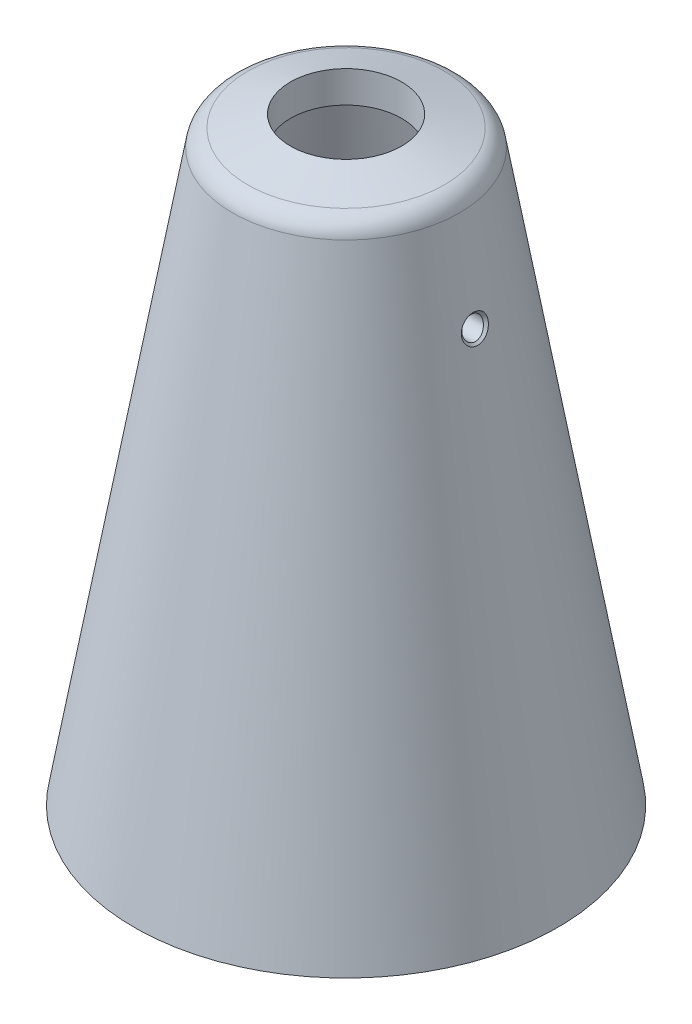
SolidWorks part; units mm, degrees
ref_plane "Front Plane" through (0, 0, 0) normal (0, 0, 1) x (1, 0, 0)
ref_plane "Top Plane" through (0, 0, 0) normal (0, 1, 0) x (1, 0, 0)
ref_plane "Right Plane" through (0, 0, 0) normal (1, 0, 0) x (0, 0, -1)
sketch "Sketch1" plane through (0, 0, 0) normal (0, 0, 1) x (1, 0, 0)
  line L0 (0, 0) -> (0, -25.4) construction
  line L1 (0, -12.7) -> (0, -82.55) construction
  line L2 (0, -82.55) -> (25.4, -82.55) construction
  line L3 (0, -12.7) -> (13.335, -12.7) construction
  line L4 (25.4, -82.55) -> (13.335, -12.7) construction
  line L5 (-3.81, -95.1738) -> (3.81, -95.1738) construction
  line L6 (11.7891, -94.5176) -> (0, 95.25) construction
  line L7 (0, 0) -> (11.7891, -94.5176) construction
  line L8 (6.6675, -12.7) -> (6.6675, -10.809) construction
  line L9 (0, -25.4) -> (15.5286, -25.4) construction
  line L10 (10.113, -12.7) -> (22.178, -82.55) construction
  line L11 (13.335, -12.7) -> (6.6675, -10.809) construction
  line L12 (0, -12.7) -> (10.6339, -15.7159) construction
  line L13 (6.6675, -10.809) -> (6.6675, -14.591) construction
  line L14 (6.6675, -14.591) -> (0, -14.591) construction
  line L15 (3.81, -95.1738) -> (3.81, -88.1137) construction
  line L16 (3.81, -88.1137) -> (19.685, -88.1137) construction
  line L17 (19.685, -88.1137) -> (19.685, -93.1937) construction
  line L18 (15.2087, -88.1137) -> (11.3126, -25.4) construction
  line L19 (12.0873, -24.13) -> (0, -24.13) construction
  circle A0 centre (0, 0) radius 95.25 construction
  circle A1 centre (0, 0) radius 12.7 construction
  circle A2 centre (0, -25.4) radius 69.85 construction
  arc A3 (3.81, -95.1738) -> (19.685, -93.1937) centre (0, 0) ccw construction
  circle A4 centre (7.4953, -25.4) radius 4.7411 construction
  point P29 (12.2364, -25.4)
  dimension "D1" = 190.5
  dimension "D3" = 25.4
  dimension "D8" = 15.875
  dimension "D2" = 25.4
  dimension "D4" = 69.85
  dimension "D5" = 50.8
  dimension "D6" = 26.67
  dimension "D7" = 7.62
  dimension "D9" = 7.11
  dimension "D10" = 3.175
  dimension "D11" = 5.08
  dimension "D12" = 2.54
  dimension "D13" = 7.62
sketch "Sketch2" plane through (0, 0, 0) normal (0, 0, 1) x (1, 0, 0)
  line L0 (0, 0) -> (0, -25.4) construction
  line L1 (0, -12.7) -> (0, -82.55) construction
  line L2 (0, -82.55) -> (25.4, -82.55) construction
  line L3 (0, -12.7) -> (13.335, -12.7) construction
  line L4 (25.4, -82.55) -> (13.335, -12.7) construction
  line L5 (-3.81, -95.1738) -> (3.81, -95.1738) construction
  line L6 (11.7891, -94.5176) -> (0, 95.25) construction
  line L7 (0, 0) -> (11.7891, -94.5176) construction
  line L8 (6.6675, -12.7) -> (6.6675, -10.809) construction
  line L9 (0, -25.4) -> (15.5286, -25.4) construction
  line L10 (10.113, -12.7) -> (22.178, -82.55) construction
  line L11 (13.335, -12.7) -> (6.6675, -10.809) construction
  line L12 (0, -12.7) -> (10.6339, -15.7159) construction
  line L13 (6.6675, -10.809) -> (6.6675, -14.591) construction
  line L14 (6.6675, -14.591) -> (0, -14.591) construction
  line L15 (3.81, -95.1738) -> (3.81, -88.1137) construction
  line L16 (3.81, -88.1137) -> (19.685, -88.1137) construction
  line L17 (19.685, -88.1137) -> (19.685, -93.1937) construction
  line L18 (15.2087, -88.1137) -> (11.3126, -25.4) construction
  line L19 (12.0873, -24.13) -> (0, -24.13) construction
  line L20 (6.6675, -10.809) -> (13.335, -12.7)
  line L21 (13.335, -12.7) -> (25.4, -82.55)
  line L22 (25.4, -82.55) -> (22.178, -82.55)
  line L23 (22.178, -82.55) -> (10.6339, -15.7159)
  line L24 (10.6339, -15.7159) -> (6.6675, -14.591)
  line L25 (6.6675, -14.591) -> (6.6675, -10.809)
  circle A0 centre (0, 0) radius 95.25 construction
  circle A1 centre (0, 0) radius 12.7 construction
  circle A2 centre (0, -25.4) radius 69.85 construction
  arc A3 (3.81, -95.1738) -> (19.685, -93.1937) centre (0, 0) ccw construction
  circle A4 centre (7.4953, -25.4) radius 4.7411 construction
  point P29 (12.2364, -25.4)
  dimension "D1" = 190.5
  dimension "D3" = 25.4
  dimension "D8" = 15.875
  dimension "D2" = 25.4
  dimension "D4" = 69.85
  dimension "D5" = 50.8
  dimension "D6" = 26.67
  dimension "D7" = 7.62
  dimension "D9" = 7.11
  dimension "D10" = 3.175
  dimension "D11" = 5.08
  dimension "D12" = 2.54
  dimension "D13" = 7.62
revolve "Revolve1" add sketch "Sketch2" angle 360 about L1
fillet "Fillet1" radius 2.54 1 edges at (-13.335, -12.7, 0)
sketch "Sketch3" plane through (0, 0, 0) normal (0, 0, 1) x (1, 0, 0)
  line L0 (0, 0) -> (0, -25.4) construction
  line L1 (0, -12.7) -> (0, -82.55) construction
  line L2 (0, -82.55) -> (25.4, -82.55) construction
  line L3 (0, -12.7) -> (13.335, -12.7) construction
  line L4 (25.4, -82.55) -> (13.335, -12.7) construction
  line L5 (-3.81, -95.1738) -> (3.81, -95.1738) construction
  line L6 (11.7891, -94.5176) -> (0, 95.25) construction
  line L7 (0, 0) -> (11.7891, -94.5176) construction
  line L8 (6.6675, -12.7) -> (6.6675, -10.809) construction
  line L9 (0, -25.4) -> (15.5286, -25.4) construction
  line L10 (10.113, -12.7) -> (22.178, -82.55) construction
  line L11 (13.335, -12.7) -> (6.6675, -10.809) construction
  line L12 (0, -12.7) -> (10.6339, -15.7159) construction
  line L13 (6.6675, -10.809) -> (6.6675, -14.591) construction
  line L14 (6.6675, -14.591) -> (0, -14.591) construction
  line L15 (3.81, -95.1738) -> (3.81, -88.1137) construction
  line L16 (3.81, -88.1137) -> (19.685, -88.1137) construction
  line L17 (19.685, -88.1137) -> (19.685, -93.1937) construction
  line L18 (15.2087, -88.1137) -> (11.3126, -25.4) construction
  line L19 (12.0873, -24.13) -> (0, -24.13) construction
  line L20 (-22.0297, -24.13) -> (22.178, -24.13)
  line L21 (22.178, -24.13) -> (22.178, -25.4)
  line L22 (22.178, -25.4) -> (-22.0297, -25.4)
  line L23 (-22.0297, -25.4) -> (-22.0297, -24.13)
  circle A0 centre (0, 0) radius 95.25 construction
  circle A1 centre (0, 0) radius 12.7 construction
  circle A2 centre (0, -25.4) radius 69.85 construction
  arc A3 (3.81, -95.1738) -> (19.685, -93.1937) centre (0, 0) ccw construction
  circle A4 centre (7.4953, -25.4) radius 4.7411 construction
  point P29 (12.2364, -25.4)
  dimension "D1" = 190.5
  dimension "D3" = 25.4
  dimension "D8" = 15.875
  dimension "D2" = 25.4
  dimension "D4" = 69.85
  dimension "D5" = 50.8
  dimension "D6" = 26.67
  dimension "D7" = 7.62
  dimension "D9" = 7.11
  dimension "D10" = 3.175
  dimension "D11" = 5.08
  dimension "D12" = 2.54
  dimension "D13" = 7.62
revolve "Cut-Revolve1" cut sketch "Sketch3" angle 360 about L22
chamfer "Chamfer2" distance 0.254 angle 45 2 edges at (-15.3808, -24.7739, 1.1049) (15.6167, -26.1143, 1.0501)
